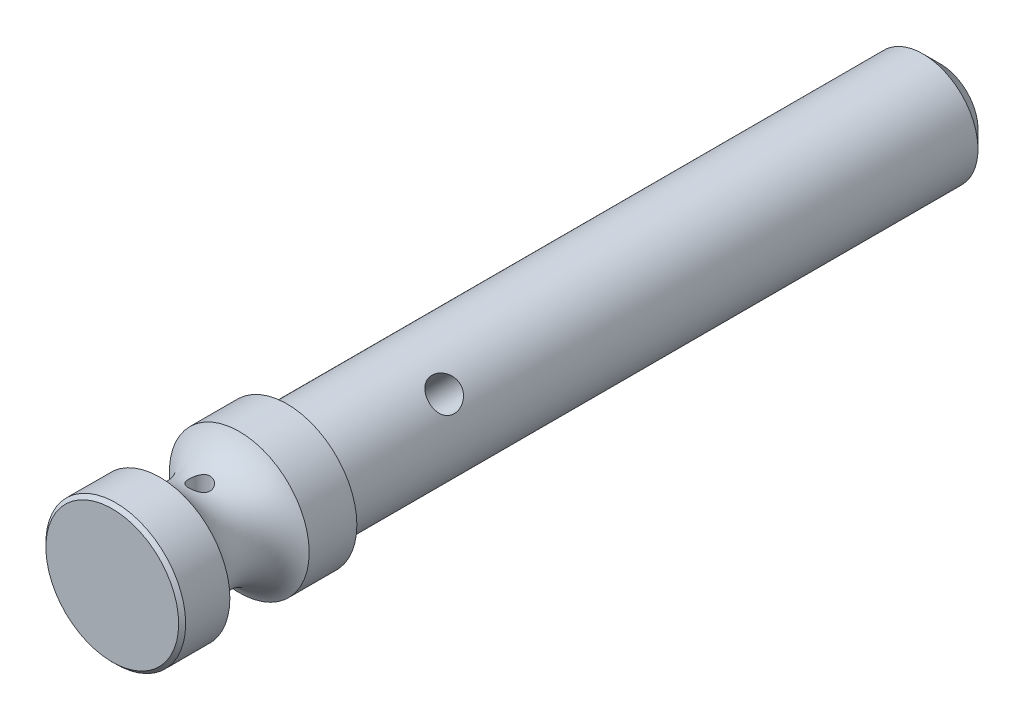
SolidWorks part; units mm, degrees
ref_plane "正面" through (0, 0, 0) normal (0, 0, 1) x (1, 0, 0)
ref_plane "平面" through (0, 0, 0) normal (0, 1, 0) x (1, 0, 0)
ref_plane "右側面" through (0, 0, 0) normal (1, 0, 0) x (0, 0, -1)
sketch "ｽｹｯﾁ1" plane through (0, 0, 0) normal (0, 0, 1) x (1, 0, 0)
  circle A0 centre (0, 0) radius 4
  dimension "D1" = 8
extrude "ﾎﾞｽ - 押し出し1" add sketch "ｽｹｯﾁ1" against normal blind 10
sketch "ｽｹｯﾁ2" plane through (0, 0, -10) normal (0, 0, -1) x (-1, 0, 0)
  circle A0 centre (0, 0) radius 3.15
  dimension "D1" = 6.3
extrude "ﾎﾞｽ - 押し出し2" add sketch "ｽｹｯﾁ2" along normal blind 37.4
sketch "ｽｹｯﾁ3" plane through (0, 0, 0) normal (0, 1, 0) x (1, 0, 0)
  line L0 (0, 0) -> (0, 7.8088) construction
  line L1 (-4, 0) -> (4, 0) construction
  line L2 (-5.05, 5) -> (-2.55, 5) construction
  line L3 (-2.55, 5) -> (0, 5) construction
  circle A0 centre (-5.05, 5) radius 2.5
  dimension "D1" = 5
  dimension "D2" = 2.55
  dimension "D3" = 5
revolve "ｶｯﾄ - 回転1" cut sketch "ｽｹｯﾁ3" angle 360 about L0
sketch "ｽｹｯﾁ4" plane through (0, 0, 0) normal (0, 1, 0) x (1, 0, 0)
  line L0 (0, 0) -> (0, 5) construction
  circle A0 centre (0, 5) radius 0.6
  dimension "D1" = 1.2
  dimension "D2" = 5
extrude "ｶｯﾄ - 押し出し1" cut sketch "ｽｹｯﾁ4" against normal through all and the other way through all
hole_wizard "Ø1.8 (1.8) 直径の穴1" positions "3Dｽｹｯﾁ1" profile "ｽｹｯﾁ5" hole size "Ø1.8" standard "JIS"
sketch3d "3Dｽｹｯﾁ1"
  line L0 (0, 0, 0) -> (0, 4, 0) construction
  line L2 (0, 0, 0) -> (2.2274, 2.2274, 0) construction
  line L3 (2.2274, 2.2274, 0) -> (2.2274, 2.2274, -16.8) construction
  circle A1 centre (0, 0, 0) radius 4 construction
  point P0 (2.2274, 2.2274, -16.8)
  point P15 (0, 0, 4)
  dimension "D1" = 45
  dimension "D2" = 16.8
sketch "ｽｹｯﾁ5" plane through (2.2274, 2.2274, -16.8) normal (0, 0, 1) x (-0.7071, 0.7071, 0)
  line L0 (0, 0) -> (0, 8.8069)
  line L1 (0, 8.8069) -> (0.9, 8.8069)
  line L2 (0.9, 8.8069) -> (0.9, 0)
  line L5 (0.9, 0) -> (0, 0)
  line L11 (0, -6.35) -> (0, 107.95) construction
  dimension "通し穴の直径" = 1.8
  dimension "通し穴の深さ" = 8.8069
chamfer "面取り1" distance 1 angle 45 1 edges at (-3.15, 0, -47.4)
chamfer "面取り2" distance 0.2 angle 45 1 edges at (4, 0, 0)
